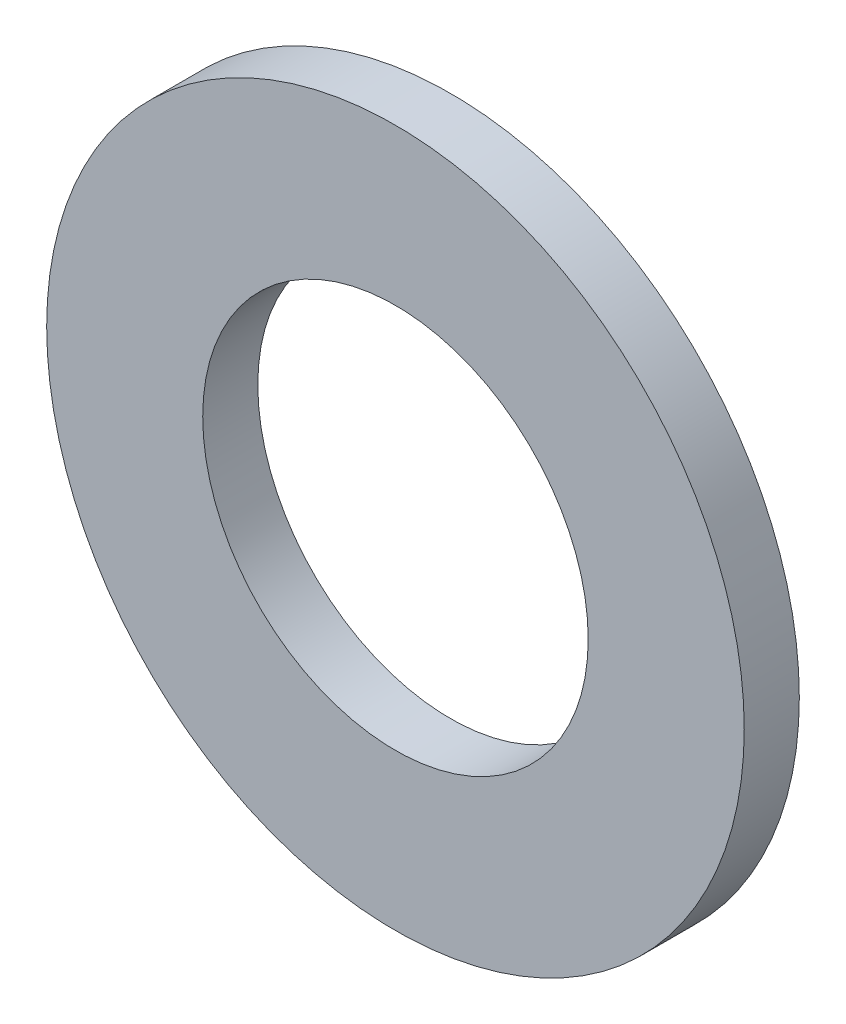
SolidWorks part; units mm, degrees
ref_plane "Płaszczyzna przednia" through (0, 0, 0) normal (0, 0, 1) x (1, 0, 0)
ref_plane "Płaszczyzna górna" through (0, 0, 0) normal (0, 1, 0) x (1, 0, 0)
ref_plane "Płaszczyzna prawa" through (0, 0, 0) normal (1, 0, 0) x (0, 0, -1)
sketch "Szkic1" plane through (0, 0, 0) normal (0, 0, 1) x (1, 0, 0)
  circle A0 centre (0, 0) radius 5.25
  circle A1 centre (0, 0) radius 9.5
  dimension "D1" = 10.5
  dimension "D2" = 19
extrude "Dodanie-wyciągnięcie1" add sketch "Szkic1" along normal blind 1.5
